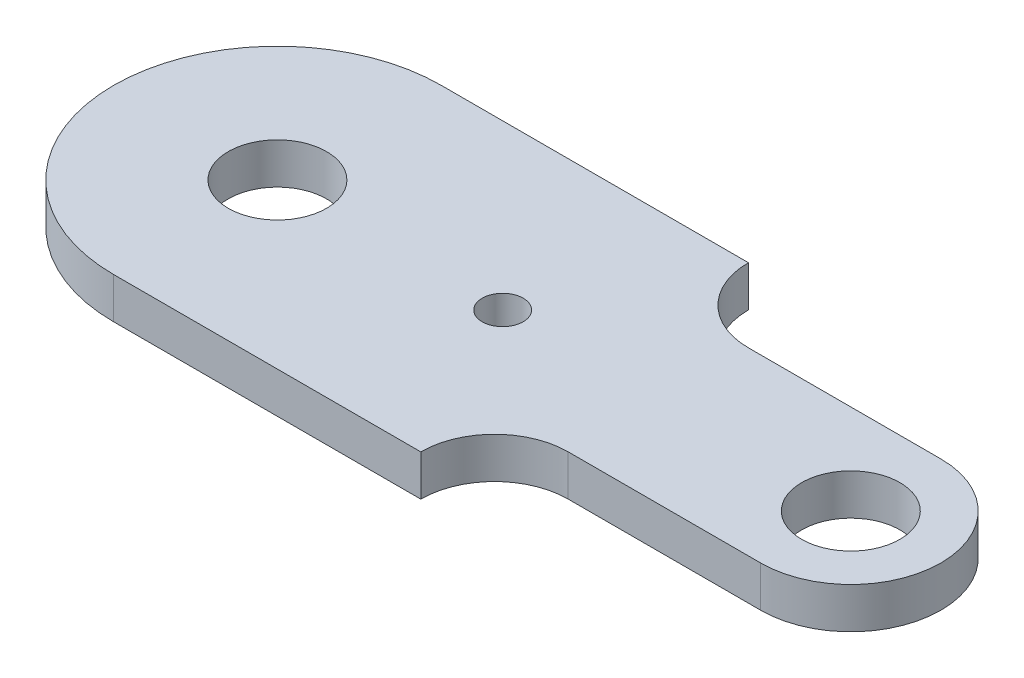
SolidWorks part; units mm, degrees
ref_plane "Front Plane" through (0, 0, 0) normal (0, 0, 1) x (1, 0, 0)
ref_plane "Top Plane" through (0, 0, 0) normal (0, 1, 0) x (1, 0, 0)
ref_plane "Right Plane" through (0, 0, 0) normal (1, 0, 0) x (0, 0, -1)
sketch "Sketch1" plane through (0, 0, 0) normal (0, 1, 0) x (1, 0, 0)
  line L0 (0, 1016) -> (1905, 1016)
  line L1 (0, -1016) -> (1905, -1016)
  line L2 (1905, -1016) -> (2362.2, -1016) construction
  line L3 (2362.2, -558.8) -> (3556, -558.8)
  line L4 (3491.5289, 0) -> (0, 0) construction
  line L5 (2362.2, 558.8) -> (3556, 558.8)
  arc A0 (0, 1016) -> (0, -1016) centre (0, 0) ccw
  circle A1 centre (0, 0) radius 304.8
  circle A2 centre (1397, 0) radius 127
  circle A3 centre (3556, 0) radius 304.8
  arc A4 (3556, -558.8) -> (3556, 558.8) centre (3556, 0) ccw
  arc A5 (2362.2, -558.8) -> (1905, -1016) centre (2362.2, -1016) ccw
  arc A6 (2362.2, 558.8) -> (1905, 1016) centre (2362.2, 1016) cw
  dimension "D1" = 609.6
  dimension "D3" = 254
  dimension "D5" = 609.6
  dimension "D7" = 1117.6
  dimension "D4" = 1397
  dimension "D6" = 3556
  dimension "D9" = 1905
  dimension "D10" = 457.2
extrude "Boss-Extrude1" add sketch "Sketch1" along normal blind 254
